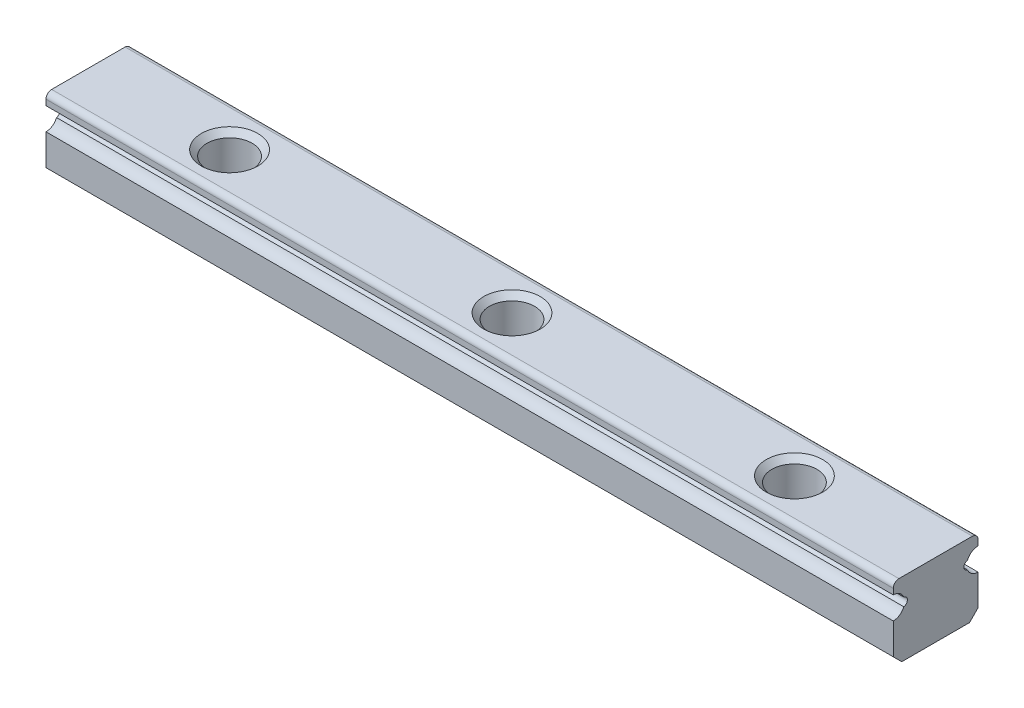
SolidWorks part; units mm, degrees
ref_plane "前基準面" through (0, 0, 0) normal (0, 0, 1) x (1, 0, 0)
ref_plane "上基準面" through (0, 0, 0) normal (0, 1, 0) x (1, 0, 0)
ref_plane "右基準面" through (0, 0, 0) normal (1, 0, 0) x (0, 0, -1)
sketch "草圖1" plane through (0, 0, 0) normal (1, 0, 0) x (0, 0, -1)
  line L0 (-1.2, 0) -> (-1.5, 0.3)
  line L1 (1.2, 0) -> (-1.2, 0)
  line L2 (1.5, 0.3) -> (1.5, 2.6)
  line L3 (1.5, 2.6) -> (-1.5, 2.6)
  line L4 (-1.5, 0.3) -> (-1.5, 2.6)
  line L5 (0, 2.6) -> (0, 2.0812) construction
  line L6 (1.2, 0) -> (1.5, 0.3)
  dimension "D1" = 3
  dimension "D2" = 2.6
  dimension "D3" = 45
  dimension "D4" = 0.3
extrude "Extrude1" add sketch "草圖1" against normal blind 30
hole_wizard "HoleWzd1" positions "草圖3" profile "草圖2" tap size "M1.6" standard "ISO"
sketch "草圖3" plane through (0, 2.6, 0) normal (0, 1, 0) x (-1, 0, 0)
  line L1 (0, -1.5) -> (0, 1.5) construction
  line L2 (30, -1.5) -> (0, -1.5) construction
  point P0 (5, 0)
  dimension "D1" = 1.5
  dimension "D2" = 5
sketch "草圖2" plane through (-5, 2.6, 0) normal (1, 0, 0) x (0, 0, 1)
  line L0 (0, 0) -> (0, 2.6)
  line L1 (0, 2.6) -> (1, 2.6)
  line L2 (0.8, 2.4) -> (0.8, 0.2)
  line L3 (0.8, 0.2) -> (1, 0)
  line L5 (1, 0) -> (0, 0)
  line L6 (-0.8, 0.2) -> (-1, 0) construction
  line L7 (1, 2.6) -> (0.8, 2.4)
  line L8 (-1, 2.6) -> (-0.8, 2.4) construction
  line L11 (0, -6.35) -> (0, 107.95) construction
  dimension "貫穿螺孔鑽直徑" = 1.6
  dimension "貫穿螺孔鑽深度" = 2.6
  dimension "近端錐孔直徑" = 2
  dimension "近端錐孔角度" = 90
  dimension "遠端錐孔直徑" = 2
  dimension "遠端錐孔角度" = 90
pattern_linear "LPattern1" count 3 spacing 10 along (-1, 0, 0) of "HoleWzd1"
sketch "Sketch2" plane through (0, 0, 0) normal (1, 0, 0) x (0, 0, -1)
  line L0 (1.15, 1.8) -> (1.6609, 1.8) construction
  line L2 (-1.2, 0) -> (1.2, 0) construction
  line L3 (1.5, 0.3) -> (1.5, 2.6) construction
  line L4 (-1.4898, 0) -> (1.5847, 0) construction
  line L6 (0, 2.2491) -> (0, 0) construction
  line L7 (-1.5, 2.6) -> (-1.5, 0.3) construction
  arc A0 (1.1286, 1.6515) -> (1.1286, 1.9485) centre (1.5, 1.8) ccw
  arc A1 (1.1286, 1.9485) -> (1.1286, 1.6515) centre (1.15, 1.8) ccw
  arc A2 (-1.1286, 1.9485) -> (-1.1286, 1.6515) centre (-1.15, 1.8) cw
  arc A3 (-1.1286, 1.6515) -> (-1.1286, 1.9485) centre (-1.5, 1.8) cw
  dimension "D1" = 0.8
  dimension "D3" = 0.35
  dimension "D4" = 0.15
  dimension "D2" = 1.8
extrude "Cut-Extrude1" cut sketch "Sketch2" against normal through all
fillet "Fillet1" radius 0.2 2 edges at (-15, 2.6, -1.5) (-15, 2.6, 1.5)
